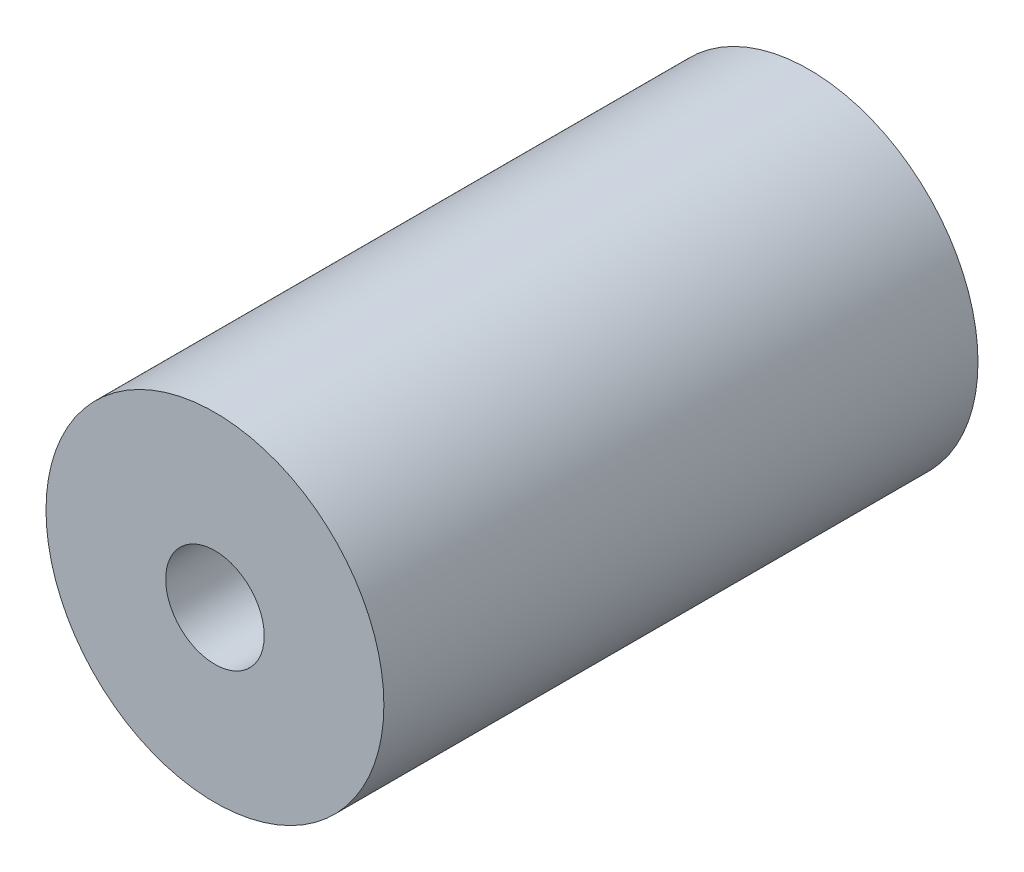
SolidWorks part; units mm, degrees
ref_plane "Plan de face" through (0, 0, 0) normal (0, 0, 1) x (1, 0, 0)
ref_plane "Plan de dessus" through (0, 0, 0) normal (0, 1, 0) x (1, 0, 0)
ref_plane "Plan de droite" through (0, 0, 0) normal (1, 0, 0) x (0, 0, -1)
sketch "Esquisse1" plane through (0, 0, 0) normal (0, 0, 1) x (1, 0, 0)
  circle A0 centre (0, 0) radius 1.75
  circle A1 centre (0, 0) radius 6
  dimension "D1" = 3.5
  dimension "D2" = 12
extrude "Boss.-Extru.1" add sketch "Esquisse1" along normal blind 21.1
